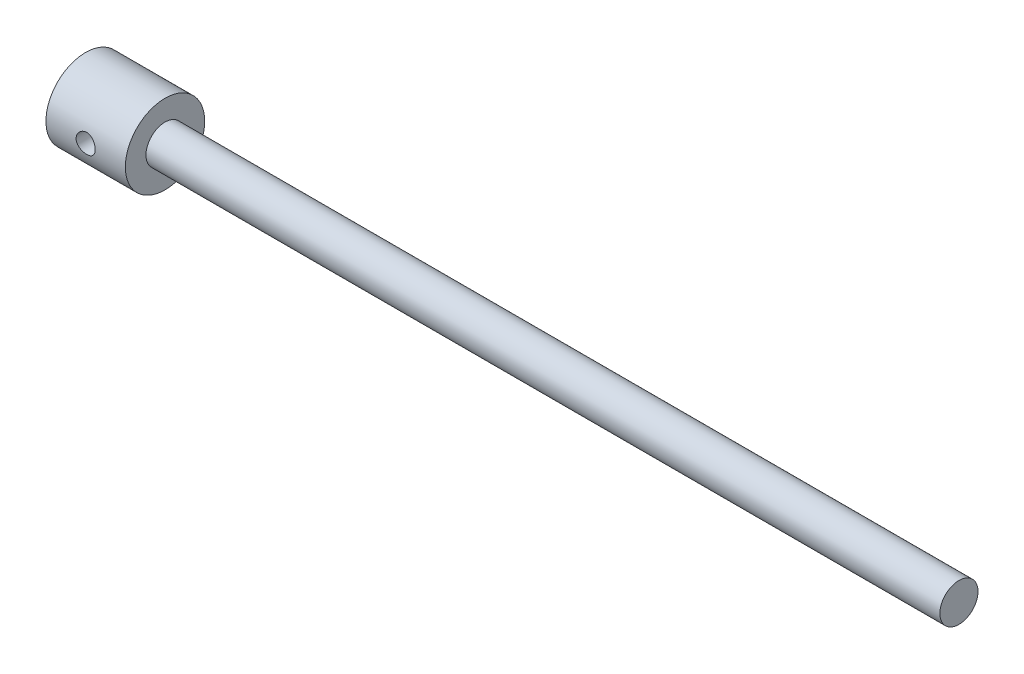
SolidWorks part; units mm, degrees
ref_plane "Front Plane" through (0, 0, 0) normal (0, 0, 1) x (1, 0, 0)
ref_plane "Top Plane" through (0, 0, 0) normal (0, 1, 0) x (1, 0, 0)
ref_plane "Right Plane" through (0, 0, 0) normal (1, 0, 0) x (0, 0, -1)
sketch "Sketch1" plane through (0, 0, 0) normal (1, 0, 0) x (0, 0, -1)
  circle A0 centre (0, 0) radius 25
  dimension "D1" = 50
extrude "Boss-Extrude1" add sketch "Sketch1" along normal blind 50
sketch "Sketch2" plane through (0, 0, 0) normal (0, 0, 1) x (1, 0, 0)
  line L0 (25, 25) -> (25, -25) construction
  line L1 (50, 25) -> (0, 25) construction
  line L2 (0, -25) -> (50, -25) construction
  line L3 (0, 0) -> (50, 0) construction
  line L4 (50, -25) -> (50, 25) construction
  circle A0 centre (25, 0) radius 6
  dimension "D1" = 12
extrude "Cut-Extrude1" cut sketch "Sketch2" against normal through all both and the other way through all
sketch "Sketch3" plane through (50, 0, 0) normal (1, 0, 0) x (0, 0, -1)
  circle A0 centre (0, 0) radius 12
  dimension "D1" = 24
extrude "Boss-Extrude2" add sketch "Sketch3" along normal blind 500
